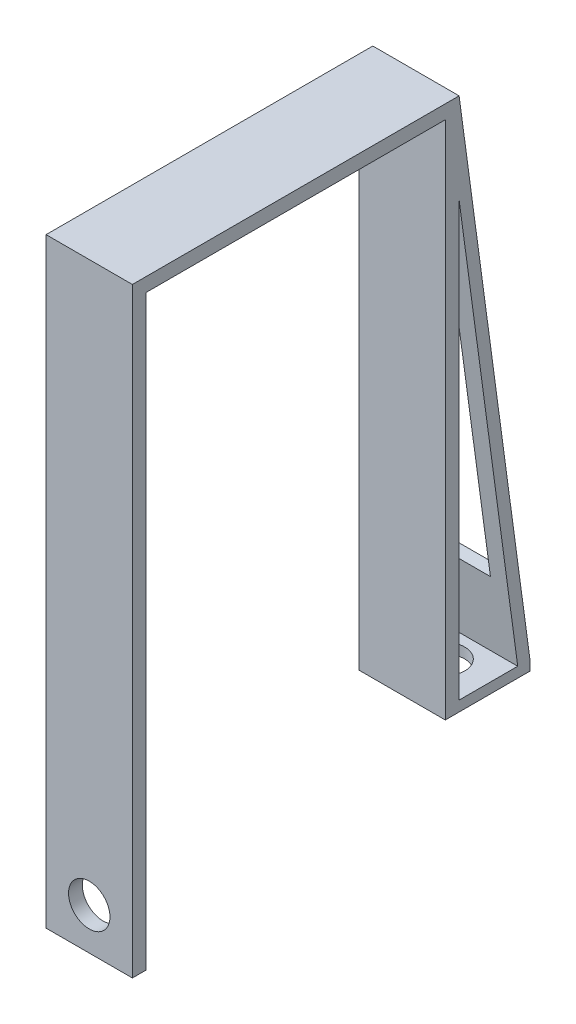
SolidWorks part; units mm, degrees
ref_plane "Front Plane" through (0, 0, 0) normal (0, 0, 1) x (1, 0, 0)
ref_plane "Top Plane" through (0, 0, 0) normal (0, 1, 0) x (1, 0, 0)
ref_plane "Right Plane" through (0, 0, 0) normal (1, 0, 0) x (0, 0, -1)
sketch "Sketch2" plane through (0, 0, 0) normal (0, 0, 1) x (1, 0, 0)
  line L1 (-123.2034, -97.4239) -> (-98.2034, -97.4239)
  line L2 (-123.2034, -97.4239) -> (-123.2034, 72.5761)
  line L3 (-123.2034, 72.5761) -> (-98.2034, 72.5761)
  line L4 (-98.2034, -97.4239) -> (-98.2034, 72.5761)
  circle A2 centre (-110.7034, -85.3746) radius 6
  dimension "D1" = 170
  dimension "D2" = 25
extrude "Boss-Extrude1" add sketch "Sketch2" along normal blind 4
sketch "Sketch3" plane through (0, 72.5761, 0) normal (0, 1, 0) x (1, 0, 0)
  line L13 (-123.2034, -4) -> (-98.2034, -4)
  line L14 (-123.2034, -4) -> (-123.2034, 86.65)
  line L15 (-123.2034, 86.65) -> (-98.2034, 86.65)
  line L16 (-98.2034, -4) -> (-98.2034, 86.65)
  dimension "D1" = 25
  dimension "D2" = 90.65
extrude "Boss-Extrude2" add sketch "Sketch3" along normal blind 4
sketch "Sketch5" plane through (0, 0, -86.65) normal (0, 0, -1) x (-1, 0, 0)
  line L9 (98.2034, -78.0239) -> (123.2034, -78.0239)
  line L10 (98.2034, -78.0239) -> (98.2034, 76.5761)
  line L11 (98.2034, 76.5761) -> (123.2034, 76.5761)
  line L12 (123.2034, -78.0239) -> (123.2034, 76.5761)
  dimension "D1" = 25
  dimension "D2" = 154.6
extrude "Boss-Extrude3" add sketch "Sketch5" along normal blind 4 contours L10 L9 L12 L11
sketch "Sketch6" plane through (-123.2034, 0, 0) normal (-1, 0, 0) x (0, 0, 1)
  line L1 (-90.65, -78.0239) -> (-111.1634, -78.0239)
  line L2 (-90.65, -78.0239) -> (-90.65, -75.0239)
  line L3 (-90.65, -75.0239) -> (-111.1634, -75.0239)
  line L4 (-111.1634, -78.0239) -> (-111.1634, -75.0239)
  dimension "D1" = 3
extrude "Boss-Extrude4" add sketch "Sketch6" along direction (-1, 0, 0) on the side against the normal up to surface (25 mm away)
sketch "Sketch8" plane through (-98.2034, 0, 0) normal (1, 0, 0) x (0, 0, -1)
  line L0 (90.65, 76.5761) -> (111.1634, -75.0239)
  line L1 (111.1634, -75.0239) -> (107.6315, -75.0239)
  line L2 (111.1634, -75.0239) -> (90.65, -75.0239) construction
  line L3 (107.6315, -75.0239) -> (90.65, 50.4744)
  line L4 (90.65, 50.4744) -> (90.65, 76.5761)
  line L5 (90.65, -75.0239) -> (90.65, 76.5761) construction
  dimension "D1" = 3.5
extrude "Boss-Extrude6" add sketch "Sketch8" against normal up to surface (25 mm away)
sketch "Sketch12" plane through (0, -78.0239, 0) normal (0, -1, 0) x (-1, 0, 0)
  circle A1 centre (110.7034, 98.7817) radius 6
extrude "Cut-Extrude2" cut sketch "Sketch12" against normal blind 4
sketch "Sketch13" plane through (0, 12.9531, -95.7271) normal (0, -0.1341, 0.991) x (1, 0, 0)
  line L0 (-98.2034, 37.8632) -> (-98.2034, -88.7787) construction
  line L1 (-118.2034, -67.1416) -> (-103.2034, -67.1416)
  line L2 (-118.2034, -67.1416) -> (-118.2034, 38.2172)
  line L3 (-118.2034, 38.2172) -> (-103.2034, 38.2172)
  line L4 (-103.2034, -67.1416) -> (-103.2034, 38.2172)
  line L5 (-123.2034, -88.7787) -> (-123.2034, 37.8632) construction
  dimension "D1" = 5
  dimension "D2" = 5
extrude "Cut-Extrude3" cut sketch "Sketch13" against normal blind 10
